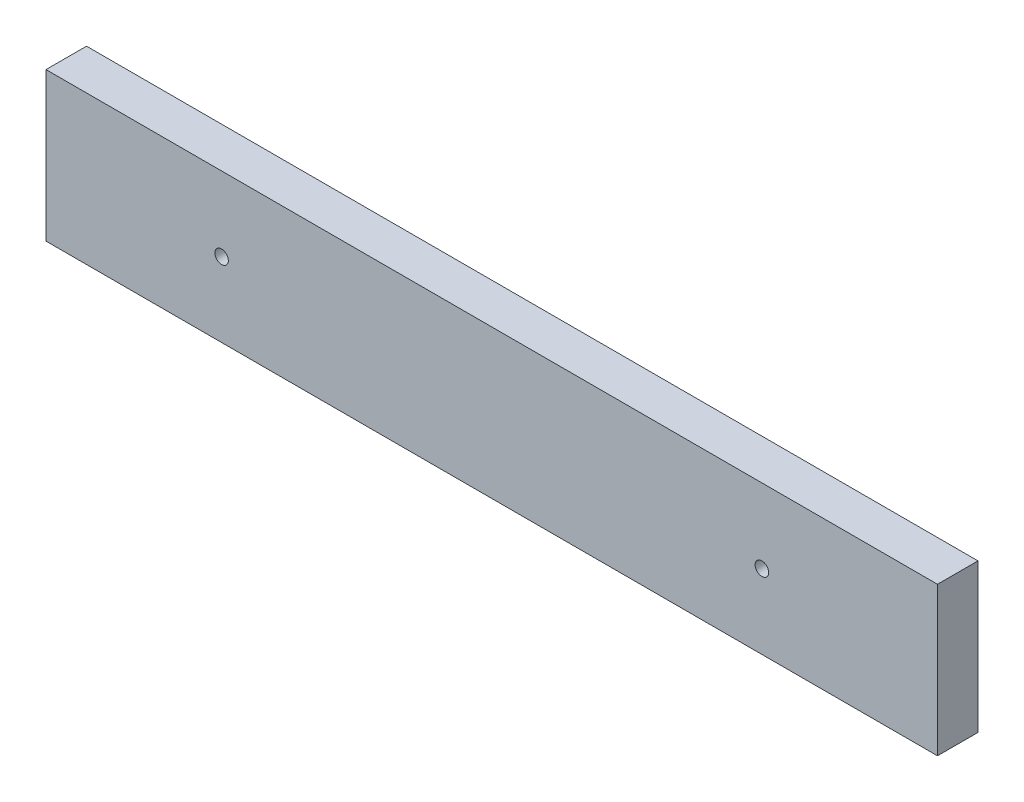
SolidWorks part; units mm, degrees
ref_plane "Front Plane" through (0, 0, 0) normal (0, 0, 1) x (1, 0, 0)
ref_plane "Top Plane" through (0, 0, 0) normal (0, 1, 0) x (1, 0, 0)
ref_plane "Right Plane" through (0, 0, 0) normal (1, 0, 0) x (0, 0, -1)
sketch "Sketch2" plane through (0, 0, 0) normal (1, 0, 0) x (0, 0, -1)
  line L1 (-19.05, 69.85) -> (19.05, 69.85)
  line L2 (-19.05, 69.85) -> (-19.05, -69.85)
  line L3 (-19.05, -69.85) -> (19.05, -69.85)
  line L4 (19.05, 69.85) -> (19.05, -69.85)
  line L5 (-19.05, 69.85) -> (19.05, -69.85) construction
  line L6 (-19.05, -69.85) -> (19.05, 69.85) construction
  point P0 (0, 0)
extrude "Boss-Extrude1" add sketch "Sketch2" along normal blind 838.2
sketch "Sketch3" plane through (0, 0, 19.05) normal (0, 0, 1) x (1, 0, 0)
  line L0 (419.1, 69.85) -> (419.1, -69.85) construction
  line L1 (838.2, 69.85) -> (0, 69.85) construction
  line L2 (838.2, -69.85) -> (0, -69.85) construction
  circle A0 centre (165.1, 0) radius 6.35
  circle A1 centre (673.1, 0) radius 6.35
  dimension "D1" = 508
  dimension "D2" = 12.7
extrude "Cut-Extrude1" cut sketch "Sketch3" against normal through all
equation "\"system_width\"= 7ft + 10 "
equation "\"system_length\"= 95.5"
equation "\"module_board_length\"= 11.25in"
equation "\"module_board_width\"= 1.5in"
equation "\"step_board_length\"= 5.5in"
equation "\"step_board_width\"= 1.5in"
equation "\"module_lip_width\"= 1.5in"
equation "\"module_trim_thickness\"= 1in"
equation "\"module_width\"= (\"system_width\" -  2* \"module_trim_thickness\") / 2"
equation "\"module_board_short_depth\"= \"module_width\" - ( 2 * \"module_board_width\" ) - \"module_lip_width\""
equation "\"module_board_hole\"= 0.5in"
equation "\"module_board_hole_seperation\"= 20in"
equation "\"system_step_length\"= 2ft+11.5"
equation "\"system_top_length\"= \"system_length\" - \"system_step_length\""
equation "\"module_top_thickness\"= 0.75in"
equation "\"module_trim_height\"= 14in"
equation "\"module_top_overhang\"= 4.5in"
equation "\"module_trim_angle\"= 45deg"
equation "\"module_length\"= (\"system_top_length\" - \"module_trim_thickness\")/ 2"
equation "\"module_board_long_depth\"= \"module_length\" - \"module_lip_width\""
equation "\"module_board_hole_position\"= ( ( \"module_width\" - \"module_board_hole_seperation\" ) / 2 ) + \"module_board_width\"/2"
equation "\"step_module_width\"= \"module_width\""
equation "\"step_module_length\"= \"system_step_length\" - \"module_trim_thickness\""
equation "\"step_board_short_depth\"= \"step_module_length\" - \"module_lip_width\""
equation "\"step_board_long_depth\"= \"step_module_width\" - (2 * \"module_board_width\") - \"module_lip_width\""
equation "\"D1@Boss-Extrude1\"=\"step_board_short_depth\""
equation "\"D2@Sketch2\"=\"step_board_length\""
equation "\"D1@Sketch2\"=\"step_board_width\""
